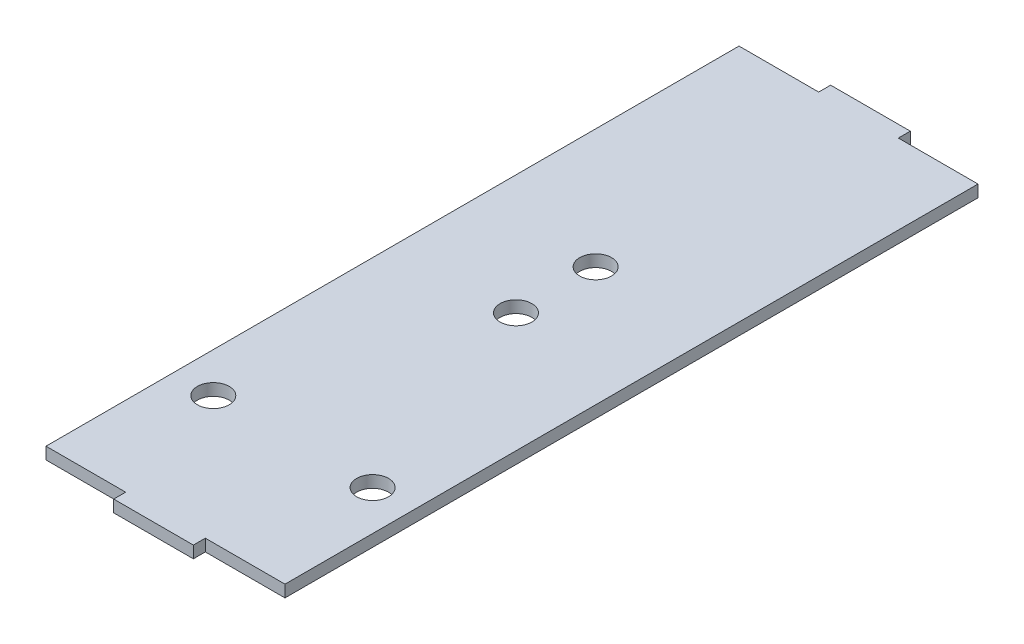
SolidWorks part; units mm, degrees
ref_plane "Plan de face" through (0, 0, 0) normal (0, 0, 1) x (1, 0, 0)
ref_plane "Plan de dessus" through (0, 0, 0) normal (0, 1, 0) x (1, 0, 0)
ref_plane "Plan de droite" through (0, 0, 0) normal (1, 0, 0) x (0, 0, -1)
sketch "Esquisse1" plane through (0, 0, 0) normal (0, 1, 0) x (1, 0, 0)
  line L1 (-30, 90) -> (30, 90)
  line L2 (-30, 90) -> (-30, -90)
  line L3 (-30, -90) -> (30, -90)
  line L4 (30, 90) -> (30, -90)
  line L5 (-30, 90) -> (30, -90) construction
  line L6 (-30, -90) -> (30, 90) construction
  point P0 (0, 0)
  dimension "D1" = 180
  dimension "D2" = 60
extrude "Boss.-Extru.1" add sketch "Esquisse1" along normal blind 3
sketch "Esquisse2" plane through (0, 3, 0) normal (0, 1, 0) x (1, 0, 0)
  line L0 (0, 0) -> (72.9157, 0) construction
  line L1 (0, 0) -> (0, 73.9049) construction
  line L2 (10, 90) -> (10, 87)
  line L3 (-30, 90) -> (-10, 90)
  line L4 (-30, 90) -> (-30, 87)
  line L5 (-30, 87) -> (-10, 87)
  line L6 (-10, 90) -> (-10, 87)
  line L7 (30, 87) -> (10, 87)
  line L8 (30, 90) -> (30, 87)
  line L9 (30, 90) -> (10, 90)
  line L10 (30, -90) -> (10, -90)
  line L11 (30, -90) -> (30, -87)
  line L12 (30, -87) -> (10, -87)
  line L13 (-10, -90) -> (-10, -87)
  line L14 (-30, -87) -> (-10, -87)
  line L15 (-30, -90) -> (-30, -87)
  line L16 (-30, -90) -> (-10, -90)
  line L17 (10, -90) -> (10, -87)
  dimension "D1" = 20
  dimension "D2" = 3
extrude "Enlèv. mat.-Extru.1" cut sketch "Esquisse2" against normal through all
sketch "Esquisse3" plane through (0, 3, 0) normal (0, 1, 0) x (1, 0, 0)
  circle A4 centre (-20, -55) radius 4 construction
  circle A5 centre (20, -55) radius 4 construction
  circle A6 centre (0, 21) radius 4 construction
  circle A7 centre (0, 1) radius 4 construction
  circle A8 centre (-20, -55) radius 4
  circle A9 centre (20, -55) radius 4
  circle A10 centre (0, 21) radius 4
  circle A11 centre (0, 1) radius 4
extrude "Enlèv. mat.-Extru.2" cut sketch "Esquisse3" against normal through all
